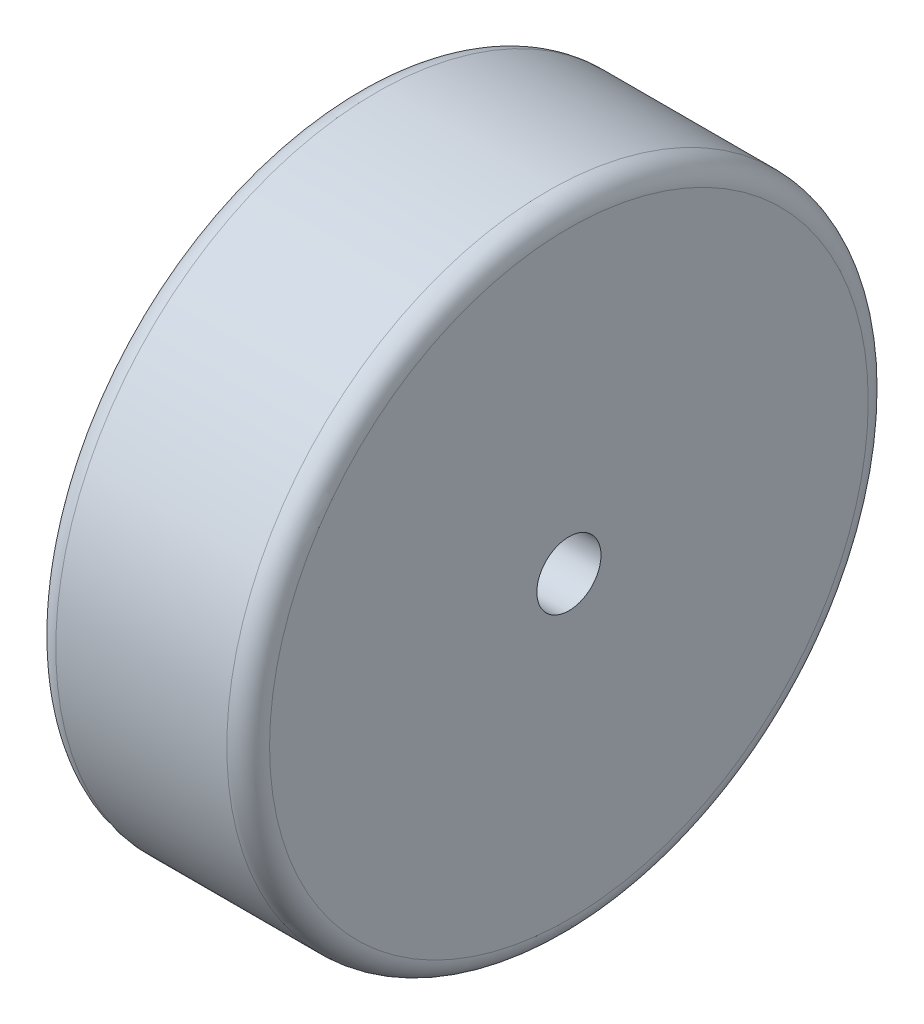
SolidWorks part; units mm, degrees
ref_plane "Vorderseite" through (0, 0, 0) normal (0, 0, 1) x (1, 0, 0)
ref_plane "Oben" through (0, 0, 0) normal (0, 1, 0) x (1, 0, 0)
ref_plane "Rechts" through (0, 0, 0) normal (1, 0, 0) x (0, 0, -1)
sketch "Skizze1" plane through (0, 0, 0) normal (0, 0, 1) x (1, 0, 0)
  line L0 (0, -50) -> (0, 50) construction
  line L3 (-40, 300) -> (40, 300)
  line L5 (-49.774, 0.678) -> (50, 300) construction
  line L6 (-50, 300) -> (50, 0) construction
  line L8 (-50, 165) -> (-50, 290)
  line L11 (-50, 165) -> (50, 165)
  line L13 (-52.158, 134.3526) -> (50, 165) construction
  line L14 (-50, 165) -> (47.0092, 135.8972) construction
  line L15 (50, 165) -> (50, 290)
  line L16 (0, 150) -> (-76.0575, 150) construction
  line L17 (50, 0) -> (-50, 0) construction
  arc A0 (40, 300) -> (50, 290) centre (40, 290) cw
  arc A1 (-50, 290) -> (-40, 300) centre (-40, 290) cw
  arc A2 (50, 250) -> (-50, 250) centre (0, 250) ccw construction
  point P0 (0, 150)
  point P10 (0, 150)
  point P16 (0, 165)
  dimension "D6" = 10
  dimension "D1" = 100
  dimension "D2" = 300
  dimension "D3" = 150
  dimension "D4" = 15
  dimension "D5" = 135
revolve "Rotation1" add sketch "Skizze1" angle 360 about L16
